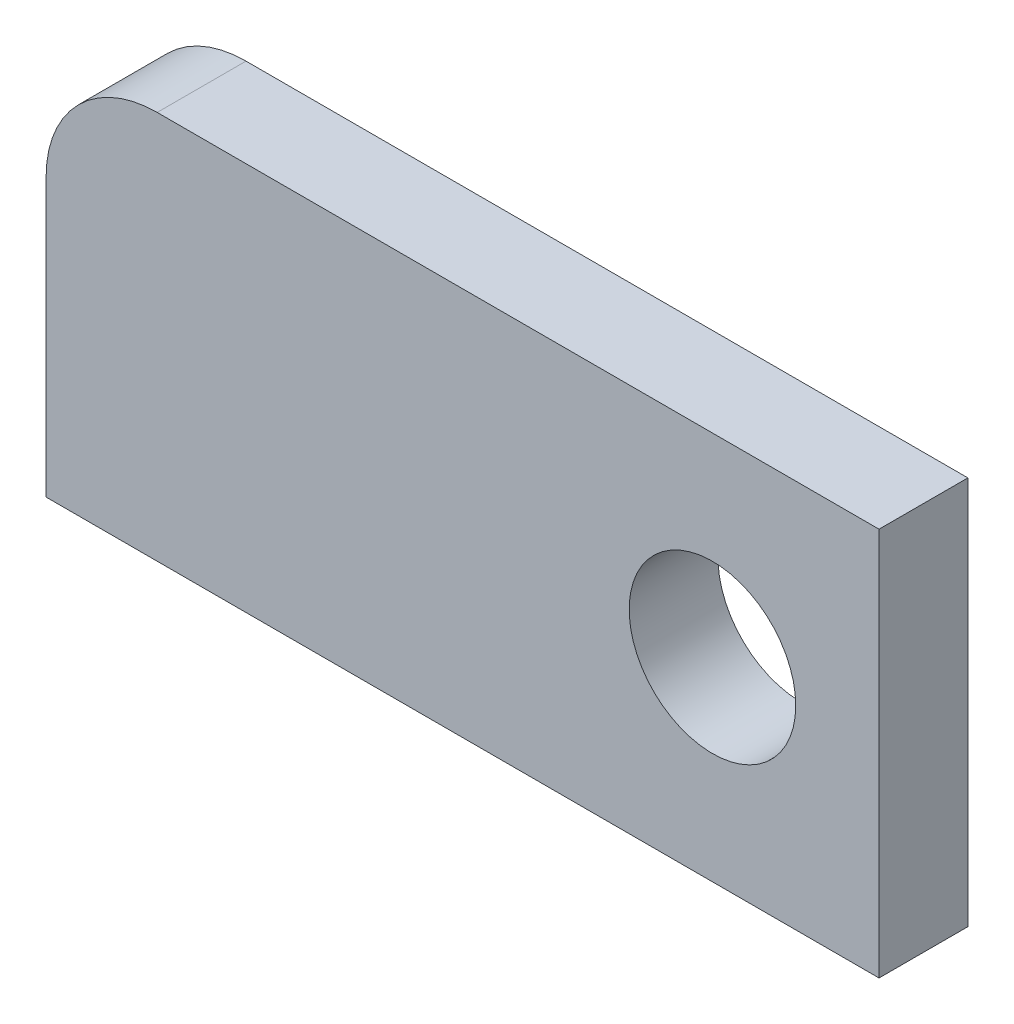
SolidWorks part; units mm, degrees
ref_plane "Plan de face" through (0, 0, 0) normal (0, 0, 1) x (1, 0, 0)
ref_plane "Plan de dessus" through (0, 0, 0) normal (0, 1, 0) x (1, 0, 0)
ref_plane "Plan de droite" through (0, 0, 0) normal (1, 0, 0) x (0, 0, -1)
sketch "Esquisse1" plane through (0, 0, 0) normal (0, 0, 1) x (1, 0, 0)
  line L1 (0, 0) -> (75, 0)
  line L2 (0, 0) -> (0, 25)
  line L3 (10, 35) -> (75, 35)
  line L4 (75, 0) -> (75, 35)
  circle A0 centre (60, 17.5) radius 7.5
  arc A1 (0, 25) -> (10, 35) centre (10, 25) cw
  point P9 (0, 35)
  dimension "D4" = 15
  dimension "D6" = 10
  dimension "D1" = 35
  dimension "D2" = 75
  dimension "D3" = 17.5
  dimension "D5" = 15
extrude "Extrusion1" add sketch "Esquisse1" along normal blind 8
